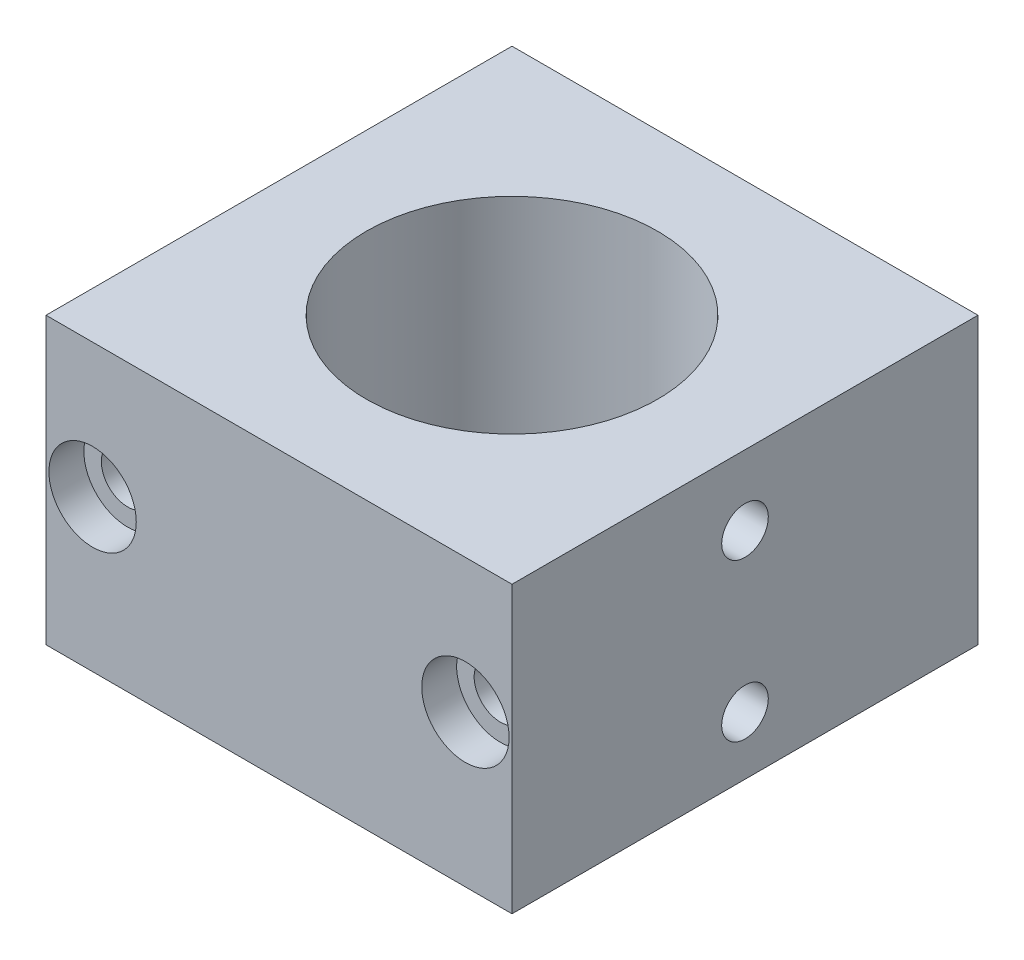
SolidWorks part; units mm, degrees
ref_plane "Plan1" through (0, 0, 0) normal (0, 0, 1) x (1, 0, 0)
ref_plane "Plan2" through (0, 0, 0) normal (0, 1, 0) x (1, 0, 0)
ref_plane "Plan3" through (0, 0, 0) normal (1, 0, 0) x (0, 0, -1)
sketch "base brut" plane through (0, 0, 0) normal (0, 0, 1) x (1, 0, 0)
  line L0 (0, 0) -> (40, 0)
  line L1 (0, 0) -> (0, 24.5)
  line L2 (40, 24.5) -> (0, 24.5)
  line L3 (40, 24.5) -> (40, 0)
  dimension "D1" = 40
  dimension "D2" = 24.5
extrude "brut" add sketch "base brut" along normal blind 40
sketch "base chambre" plane through (0, 24.5, 0) normal (0, 1, 0) x (-1, 0, 0)
  line L0 (-40, 0) -> (0, 0) construction
  line L1 (0, 40) -> (0, 0) construction
  circle A0 centre (-20, 20) radius 12.5
  dimension "D1" = 25
  dimension "D2" = 20
  dimension "D3" = 20
extrude "alèsage chambre" cut sketch "base chambre" against normal blind 19.5
sketch "point d'encrage B"
  point P0 (-20, 20)
hole_wizard "Perçage alim" positions "Esquisse16" profile "Esquisse15" legacy
sketch "Esquisse16" plane through (40, 0, 0) normal (1, 0, 0) x (0, 0, -1)
  line L0 (0, 24.5) -> (0, 0) construction
  line L1 (-40, 0) -> (0, 0) construction
  point P0 (-20, 5)
  dimension "D1" = 20
  dimension "D2" = 5
sketch "Esquisse15" plane through (40, 5, 20) normal (0, 1, 0) x (0, 0, -1)
  line L0 (0, 0) -> (0, 9.3004)
  line L1 (0, 9.3004) -> (0.5, 9)
  line L2 (0.5, 9) -> (0.5, 0)
  line L4 (0.5, 0) -> (0, 0)
  line L6 (0, 9.3004) -> (-0.5, 9) construction
  line L7 (0, -4.2442) -> (0, 117.3081) construction
  dimension "Diamètre" = 1
  dimension "Profondeur" = 9
  dimension "Angle" = 118
sketch "base alès" plane through (0, 0, 0) normal (0, -1, 0) x (1, 0, 0)
  line L0 (0, 0) -> (40, 0) construction
  line L1 (0, 40) -> (0, 0) construction
  circle A0 centre (20, 20) radius 10
  dimension "D1" = 20
  dimension "D2" = 20
  dimension "D3" = 20
extrude "alèsage position" cut sketch "base alès" against normal blind 2
hole_wizard "perç +lamage" positions "base per+lam" profile "base bib" legacy
sketch "base per+lam" plane through (0, 0, 40) normal (0, 0, 1) x (1, 0, 0)
  line L0 (0, 0) -> (40, 0) construction
  line L1 (0, 0) -> (0, 24.5) construction
  point P0 (4, 13)
  dimension "D1" = 13
  dimension "D2" = 4
sketch "base bib" plane through (4, 13, 40) normal (1, 0, 0) x (0, -1, 0)
  line L0 (0, 0) -> (0, 42.5)
  line L1 (0, 42.5) -> (2.25, 42.5)
  line L2 (2.25, 42.5) -> (2.25, 3)
  line L3 (2.25, 3) -> (3.75, 3)
  line L4 (3.75, 3) -> (3.75, 0)
  line L5 (3.75, 0) -> (0, 0)
  line L6 (0, 110) -> (0, -10) construction
  dimension "Diamètre" = 4.5
  dimension "Profondeur" = 42.5
  dimension "Diamètre chambrage" = 7.5
  dimension "Profondeur chambrage" = 3
pattern_linear "2 eme perç+lam" count 2 spacing 32
hole_wizard "perç pour racc" positions "Esquisse13" profile "Esquisse12" legacy
sketch "Esquisse13" plane through (40, 0, 0) normal (1, 0, 0) x (0, 0, -1)
  line L0 (0, 24.5) -> (0, 0) construction
  line L1 (-40, 0) -> (0, 0) construction
  point P0 (-20, 5)
  dimension "D1" = 20
  dimension "D2" = 5
sketch "Esquisse12" plane through (40, 5, 20) normal (0, 1, 0) x (0, 0, -1)
  line L0 (0, 0) -> (0, 6)
  line L1 (0, 6) -> (2, 6)
  line L2 (2, 6) -> (2, 0)
  line L3 (2, 0) -> (0, 0)
  line L4 (0, 110) -> (0, -10) construction
  dimension "Diamètre" = 4
  dimension "Profondeur" = 6
pattern_linear "2ème perç racc" count 2 spacing 13.5
pattern_linear "2ème perç alim" count 2 spacing 12
